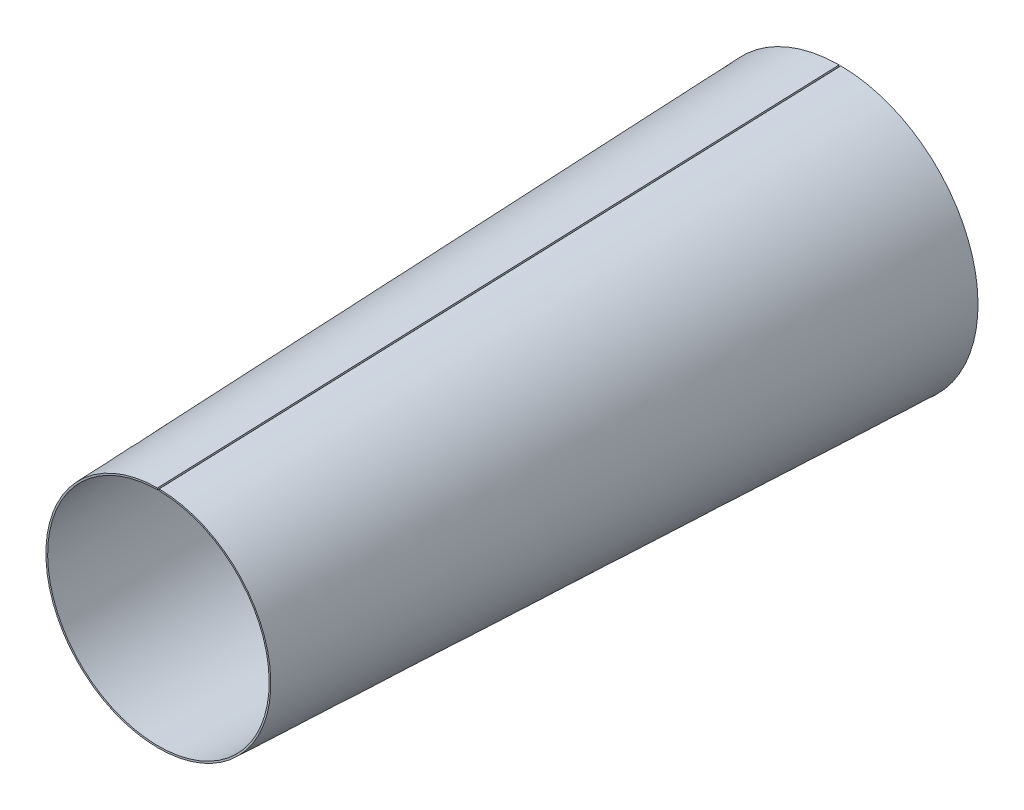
SolidWorks part; units mm, degrees
ref_plane "Ebene vorne" through (0, 0, 0) normal (0, 0, 1) x (1, 0, 0)
ref_plane "Ebene oben" through (0, 0, 0) normal (0, 1, 0) x (1, 0, 0)
ref_plane "Ebene rechts" through (0, 0, 0) normal (1, 0, 0) x (0, 0, -1)
sketch "Skizze1" plane through (0, 0, 0) normal (0, 0, 1) x (1, 0, 0)
  line L0 (0, 40) -> (0, 0) construction
  arc A0 (-0.25, 39.9992) -> (0.25, 39.9992) centre (0, 0) ccw
  circle A1 centre (0, 40) radius 0.25 construction
  dimension "D1" = 80
  dimension "D2" = 0.5
ref_plane "Ebene1" through (0, 0, 200) normal (0, 0, 1) x (1, 0, 0)
sketch "Skizze2" plane through (0, 0, 200) normal (0, 0, 1) x (1, 0, 0)
  line L0 (0, 32.5) -> (0, 0) construction
  arc A0 (-0.25, 32.499) -> (0.25, 32.499) centre (0, 0) ccw
  circle A1 centre (0, 32.5) radius 0.25 construction
  dimension "D1" = 65
  dimension "D2" = 0.5
sheet metal parameters "Blech1" thickness 0.5 parameters "D1"=1, "Dicke"=0.5
lofted bend "Ausgeformte Biegungen1" parameters "D1"=0, "D12"=0.5
other "Freiform-Biegung1" parameters "D1"=1000, "D4"=57.296, "D5"=1
sketch "Skizze4" plane through (0, 0, 0) normal (1, 0, 0) x (0, 0, -1)
  line L0 (0, 0) -> (-66.6667, 0) construction
  line L2 (-66.6667, 0) -> (-133.3333, 0) construction
  line L3 (-133.3333, 0) -> (-200, 0) construction
  line L4 (-200, 44.5533) -> (-200, -44.5533) construction
  line L5 (-152.0063, 51.3036) -> (-112.9962, -55.8758)
  line L6 (-133.3333, 0) -> (-133.3333, -56.544) construction
  line L7 (-92.8993, -56.2561) -> (-40.2794, 56.5877)
  line L9 (-66.6667, 0) -> (-66.6667, -58.6549) construction
  dimension "D1" = 20
  dimension "D2" = 25
surface "Oberfläche-Linear austragen1" sketch "Skizze4" parameters "D1"=100, "D2"=100
other "Oberflächenschnitt1" [suppressed]
other "Oberflächenschnitt2" [suppressed]
other "Oberflächenschnitt3" [suppressed]
other "Oberflächenschnitt4" [suppressed]
flat pattern "Abwicklung1"
sketch "Biegung-Linien1" plane through (0, 0, 0) normal (0, 1, 0) x (-1, 0, 0)
other "Abwickeln-<Freiform-Biegung1>1"
equation "\"LÄNGE\"=0"
equation "\"BREITE\"=0"
equation "\"HÖHE\"=0"
equation "\"DURCHMESSER\"=0"
equation "\"Stückzahl\"= 1"
